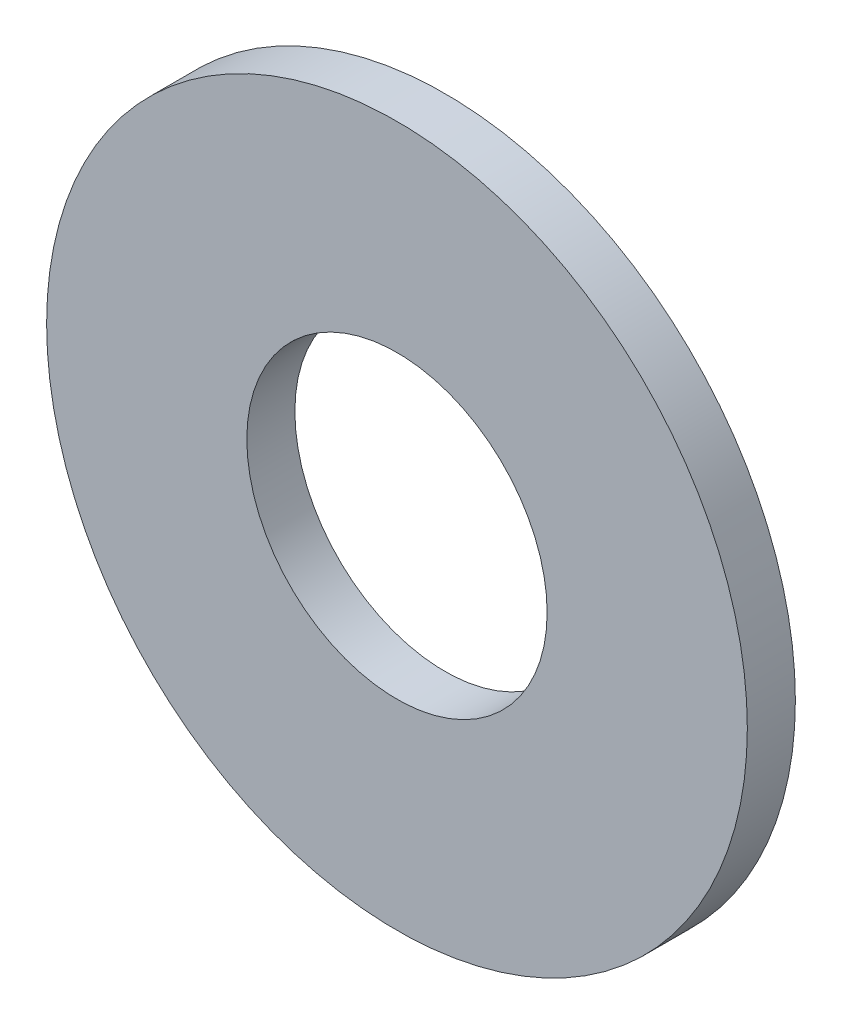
SolidWorks part; units mm, degrees
ref_plane "Front Plane" through (0, 0, 0) normal (0, 0, 1) x (1, 0, 0)
ref_plane "Top Plane" through (0, 0, 0) normal (0, 1, 0) x (1, 0, 0)
ref_plane "Right Plane" through (0, 0, 0) normal (1, 0, 0) x (0, 0, -1)
sketch "Sketch1" plane through (0, 0, 0) normal (0, 0, 1) x (1, 0, 0)
  circle A0 centre (0, 0) radius 2.3812
  circle A1 centre (0, 0) radius 5.5562
  dimension "ID" = 4.7625
  dimension "OD" = 11.1125
extrude "Extrude1" add sketch "Sketch1" against normal blind 0.762
